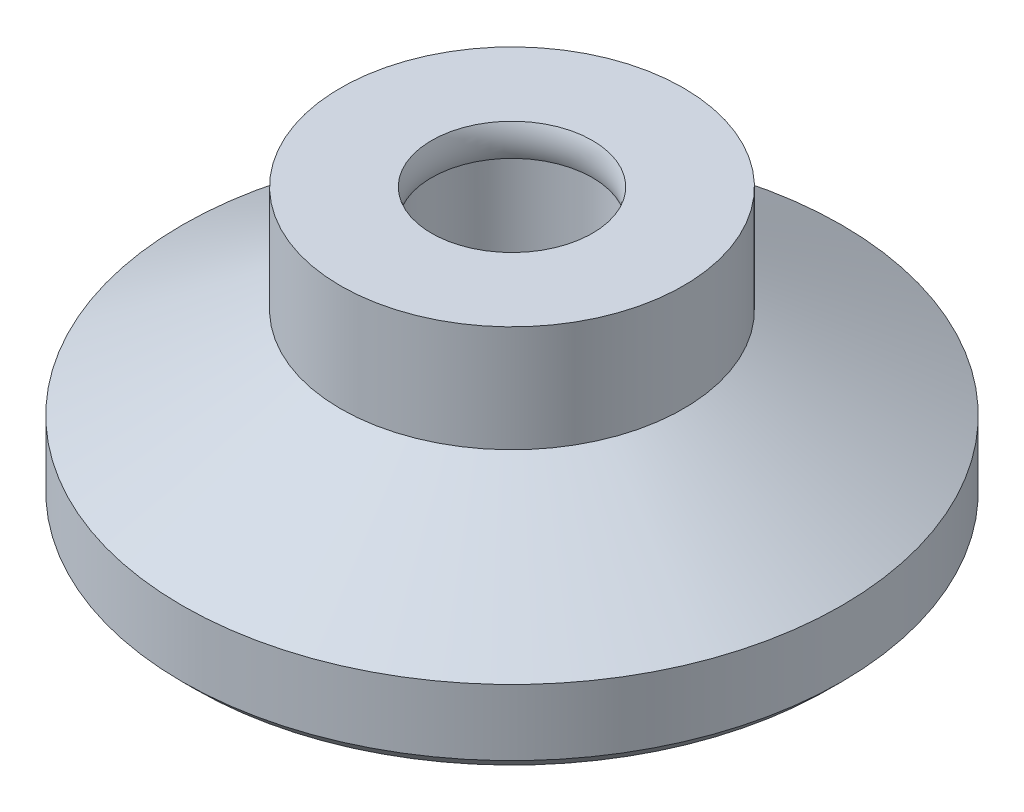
SolidWorks part; units mm, degrees
ref_plane "Front Plane" through (0, 0, 0) normal (0, 0, 1) x (1, 0, 0)
ref_plane "Top Plane" through (0, 0, 0) normal (0, 1, 0) x (1, 0, 0)
ref_plane "Right Plane" through (0, 0, 0) normal (1, 0, 0) x (0, 0, -1)
sketch "Sketch1" plane through (0, 0, 0) normal (0, 1, 0) x (1, 0, 0)
  circle A0 centre (0, 0) radius 6.5
  dimension "D1" = 13
extrude "Extrude1" add sketch "Sketch1" along normal mid plane 10.5
sketch "Sketch3" plane through (0, -5.25, 0) normal (0, -1, 0) x (1, 0, 0)
  circle A0 centre (0, 0) radius 12.5
  dimension "D1" = 25
extrude "Extrude2" add sketch "Sketch3" against normal blind 3
sketch "Sketch4" plane through (0, 0, 0) normal (0, 0, 1) x (1, 0, 0)
  line L0 (-12.5, -2.25) -> (-6.5, 1.2141)
  line L1 (-6.5, 5.25) -> (-6.5, -2.25) construction
  line L2 (-6.5, 1.2141) -> (-6.5, -2.25)
  line L3 (-6.5, -2.25) -> (-12.5, -2.25)
  dimension "D1" = 30
revolve "Revolve1" add sketch "Sketch4" angle 360 about axis through (0, 5.25, 0) along (0, -1, 0)
chamfer "Chamfer1" distance 0.5 angle 45 1 edges at (0, -5.25, -12.5)
sketch "Sketch5" plane through (0, 0, 0) normal (0, 0, 1) x (1, 0, 0)
  line L1 (0, 0) -> (0, 11.3083) construction
  line L2 (0, 5.25) -> (3.05, 5.25)
  line L3 (6.5, 5.25) -> (-6.5, 5.25) construction
  line L4 (3.05, 4.03) -> (3.05, -0.4891)
  line L5 (3.05, -0.4891) -> (0, -2.25)
  line L6 (0, -2.25) -> (0, 5.25)
  line L7 (12.5, -2.25) -> (-12.5, -2.25) construction
  arc A0 (3.05, 5.25) -> (3.05, 4.03) centre (4.514, 4.64) ccw
  point P14 (2.928, 4.64)
  dimension "D2" = 6.1
  dimension "D1" = 60
  dimension "D3" = 1.22
  dimension "D4" = 0.122
revolve "Cut-Revolve1" cut sketch "Sketch5" angle 360 about L1
equation "\"D3@Sketch5\" = \"D2@Sketch5\"*0.2"
equation "\"D4@Sketch5\" = \"D3@Sketch5\"*0.1"
